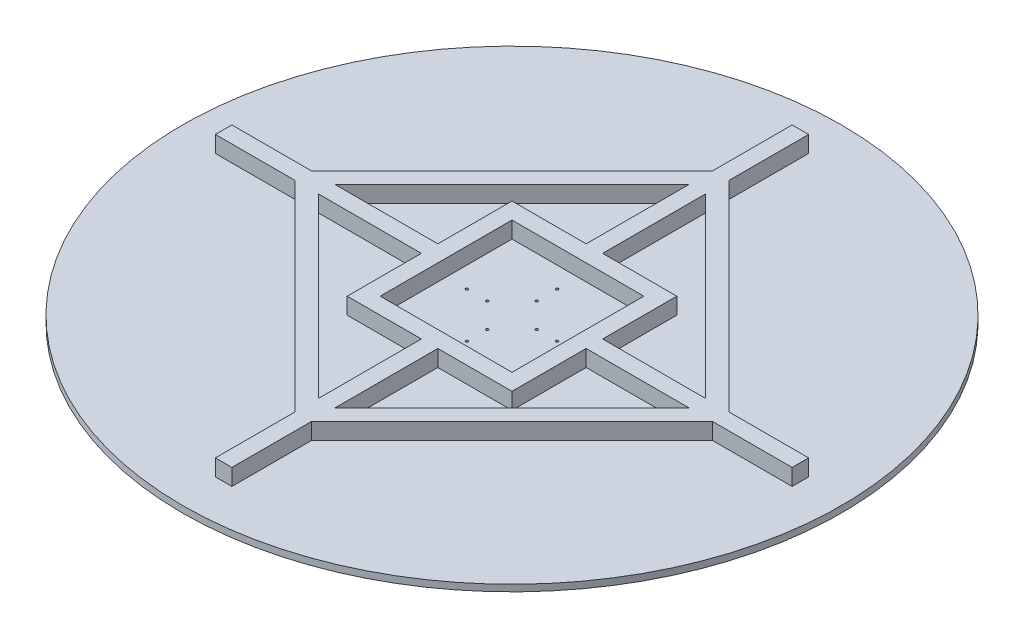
SolidWorks part; units mm, degrees
ref_plane "前视基准面" through (0, 0, 0) normal (0, 0, 1) x (1, 0, 0)
ref_plane "上视基准面" through (0, 0, 0) normal (0, 1, 0) x (1, 0, 0)
ref_plane "右视基准面" through (0, 0, 0) normal (1, 0, 0) x (0, 0, -1)
sketch "草图1" plane through (0, 0, 0) normal (0, 1, 0) x (1, 0, 0)
  line L0 (-53.25, 0) -> (53.25, 0) construction
  line L1 (0, 53.25) -> (0, -53.25) construction
  circle A0 centre (0, 0) radius 400
  circle A1 centre (0, 0) radius 53.25 construction
  circle A2 centre (54.8, 0) radius 1.55
  circle A3 centre (0, -54.8) radius 1.55
  circle A4 centre (-54.8, 0) radius 1.55
  circle A5 centre (0, 54.8) radius 1.55
  point P19 (0, 0)
  dimension "D1" = 800
  dimension "D2" = 106.5
  dimension "D3" = 3.1
  dimension "D4" = 4
extrude "凸台-拉伸1" add sketch "草图1" along normal blind 8
sketch "草图3" plane through (0, 8, 0) normal (0, 1, 0) x (1, 0, 0)
  circle A0 centre (0, 0) radius 30 construction
  circle A1 centre (30, 0) radius 1.55
  circle A2 centre (0, -30) radius 1.55
  circle A3 centre (-30, 0) radius 1.55
  circle A4 centre (0, 30) radius 1.55
  point P14 (0, 0)
  dimension "D1" = 60
  dimension "D2" = 3.1
  dimension "D3" = 4
extrude "切除-拉伸1" cut sketch "草图3" against normal blind 8
sketch "草图4" plane through (0, 8, 0) normal (0, 1, 0) x (1, 0, 0)
  line L0 (100, -100) -> (100, -10)
  line L1 (-80, -80) -> (80, -80)
  line L2 (-80, -80) -> (-80, 80)
  line L3 (-80, 80) -> (80, 80)
  line L4 (80, -80) -> (80, 80)
  line L5 (-80, -80) -> (80, 80) construction
  line L6 (-80, 80) -> (80, -80) construction
  line L7 (-100, 100) -> (-10, 100)
  line L8 (-100, -100) -> (-100, -10)
  line L9 (-100, -100) -> (-10, -100)
  line L10 (-10, 100) -> (-10, 225)
  line L11 (10, 350) -> (10, 253.2843)
  line L12 (-10, 350) -> (10, 350)
  line L13 (0, 0) -> (0, 350) construction
  line L14 (100, 10) -> (225, 10)
  line L15 (350, -10) -> (253.2843, -10)
  line L16 (350, 10) -> (350, -10)
  line L17 (0, 0) -> (350, 0) construction
  line L18 (10, -100) -> (10, -225)
  line L19 (-10, -350) -> (-10, -253.2843)
  line L20 (10, -350) -> (-10, -350)
  line L21 (0, 0) -> (0, -350) construction
  line L22 (-100, -10) -> (-225, -10)
  line L23 (-350, 10) -> (-253.2843, 10)
  line L24 (-350, -10) -> (-350, 10)
  line L25 (0, 0) -> (-350, 0) construction
  line L26 (-10, 225) -> (-225, 10)
  line L27 (-10, 253.2843) -> (-253.2843, 10)
  line L28 (225, 10) -> (10, 225)
  line L29 (253.2843, 10) -> (10, 253.2843)
  line L30 (10, -225) -> (225, -10)
  line L31 (10, -253.2843) -> (253.2843, -10)
  line L32 (-225, -10) -> (-10, -225)
  line L33 (-253.2843, -10) -> (-10, -253.2843)
  line L34 (-10, 253.2843) -> (-10, 350)
  line L35 (10, 225) -> (10, 100)
  line L36 (10, 100) -> (100, 100)
  line L37 (-100, 100) -> (100, 100) construction
  line L38 (-100, 10) -> (-100, 100)
  line L39 (-100, -100) -> (-100, 100) construction
  line L40 (-253.2843, -10) -> (-350, -10)
  line L41 (-225, 10) -> (-100, 10)
  line L42 (100, 10) -> (100, 100)
  line L43 (100, -100) -> (100, 100) construction
  line L44 (225, -10) -> (100, -10)
  line L45 (253.2843, 10) -> (350, 10)
  line L46 (-10, -225) -> (-10, -100)
  line L47 (10, -253.2843) -> (10, -350)
  line L48 (10, -100) -> (100, -100)
  line L49 (-100, -100) -> (100, -100) construction
  point P0 (0, 0)
  point P34 (0, 0)
  point P51 (0, 0)
  dimension "D1" = 160
  dimension "D2" = 160
  dimension "D4" = 20
  dimension "D5" = 250
  dimension "D7" = 20
  dimension "D3" = 20
  dimension "D6" = 4
  dimension "D8" = 4
extrude "凸台-拉伸2" add sketch "草图4" along normal blind 20
